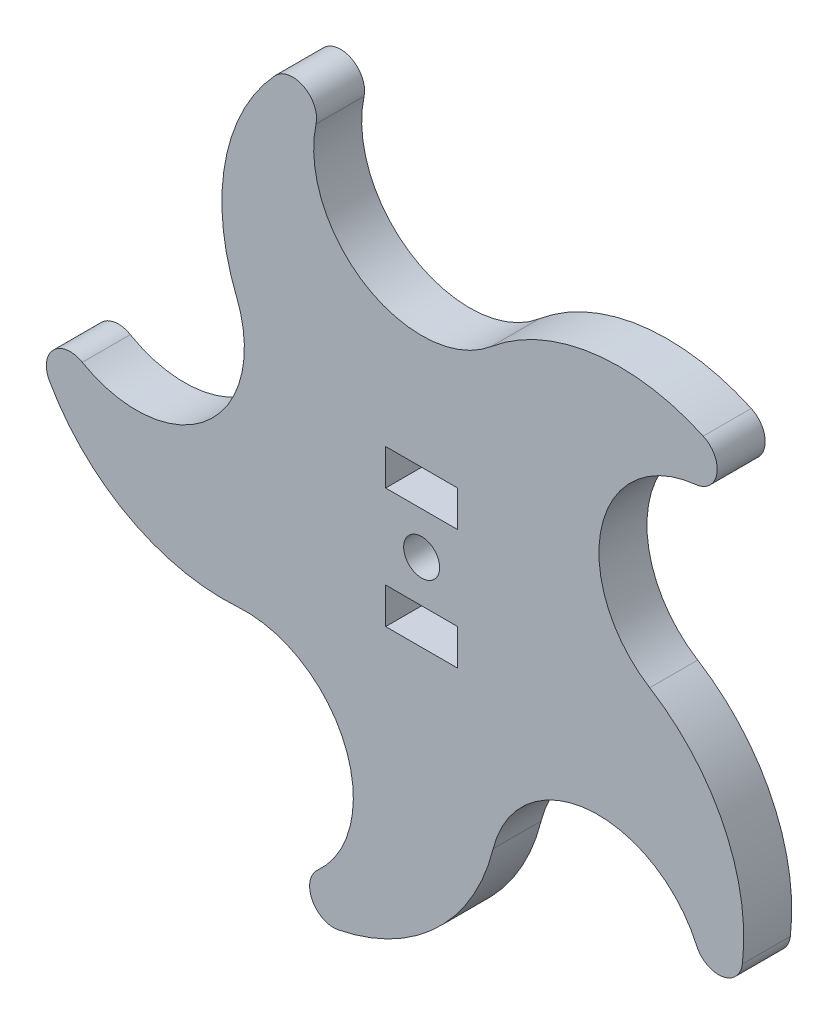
SolidWorks part; units mm, degrees
ref_plane "前视基准面" through (0, 0, 0) normal (0, 0, 1) x (1, 0, 0)
ref_plane "上视基准面" through (0, 0, 0) normal (0, 1, 0) x (1, 0, 0)
ref_plane "右视基准面" through (0, 0, 0) normal (1, 0, 0) x (0, 0, -1)
sketch "草图1" plane through (0, 0, 0) normal (0, 0, 1) x (1, 0, 0)
  line L0 (0, 0) -> (-23.7764, 7.7254) construction
  circle A0 centre (0, 0) radius 12.5
  circle A1 centre (0, 25) radius 12.5
  circle A2 centre (23.7764, 7.7254) radius 12.5
  circle A3 centre (14.6946, -20.2254) radius 12.5
  circle A4 centre (-14.6946, -20.2254) radius 12.5
  circle A5 centre (-23.7764, 7.7254) radius 12.5
  circle A6 centre (-23.7764, 7.7254) radius 10.5
  circle A7 centre (0, 25) radius 10.5
  circle A8 centre (23.7764, 7.7254) radius 10.5
  circle A9 centre (-14.6946, -20.2254) radius 10.5
  circle A10 centre (14.6946, -20.2254) radius 10.5
  circle A11 centre (-23.7764, 7.7254) radius 9
  circle A12 centre (0, 25) radius 9
  circle A13 centre (23.7764, 7.7254) radius 9
  circle A14 centre (14.6946, -20.2254) radius 9
  circle A15 centre (-14.6946, -20.2254) radius 9
  circle A17 centre (0, 0) radius 35.5
  point P16 (0, 0)
  dimension "D1" = 25
  dimension "D2" = 25
  dimension "D4" = 21
  dimension "D5" = 21
  dimension "D6" = 21
  dimension "D7" = 21
  dimension "D8" = 18
  dimension "D11" = 21
  dimension "D3" = 5
  dimension "D10" = 25
  dimension "D9" = 5
sketch "草图2" plane through (0, 0, 0) normal (0, 0, 1) x (1, 0, 0)
  line L10 (0, 0) -> (-16.5005, 5.3613) construction
  circle A26 centre (-14.6946, -20.2254) radius 9 construction
  arc A27 (-8.677, -26.9178) -> (-15.3282, -11.2478) centre (-14.6946, -20.2254) ccw
  circle A28 centre (0, 25) radius 9 construction
  circle A29 centre (14.6946, -20.2254) radius 9 construction
  circle A30 centre (23.7764, 7.7254) radius 9 construction
  circle A31 centre (-23.7764, 7.7254) radius 9 construction
  arc A32 (-8.8021, 26.8772) -> (5.7895, 18.1093) centre (0, 25) ccw
  arc A33 (22.919, -16.5704) -> (5.9606, -18.0538) centre (14.6946, -20.2254) ccw
  arc A34 (22.8418, 16.6768) -> (19.0121, 0.0899) centre (23.7764, 7.7254) ccw
  arc A35 (-28.2817, -0.0657) -> (-15.4339, 11.1023) centre (-23.7764, 7.7254) ccw
  arc A36 (-31.0279, -2.7743) -> (-15.3282, -11.2478) centre (-16.5005, 5.3613) ccw
  arc A37 (-28.2817, -0.0657) -> (-31.0279, -2.7743) centre (-29.2829, -1.7971) ccw
  arc A38 (-8.8021, 26.8772) -> (-12.2267, 28.652) centre (-10.7581, 27.2944) ccw
  arc A39 (-12.2267, 28.652) -> (-15.4339, 11.1023) centre (0, 17.3496) ccw
  arc A40 (22.8418, 16.6768) -> (23.4714, 20.4822) centre (22.6341, 18.6659) ccw
  arc A41 (23.4714, 20.4822) -> (5.7895, 18.1093) centre (16.5005, 5.3613) ccw
  arc A42 (22.919, -16.5704) -> (26.7328, -15.9933) centre (24.7467, -15.7582) ccw
  arc A43 (26.7328, -15.9933) -> (19.0121, 0.0899) centre (10.1978, -14.0361) ccw
  arc A44 (-8.677, -26.9178) -> (-6.9496, -30.3666) centre (-7.3398, -28.405) ccw
  arc A45 (-6.9496, -30.3666) -> (5.9606, -18.0538) centre (-10.1978, -14.0361) ccw
  dimension "D1" = 4
extrude "凸台-拉伸1" add sketch "草图2" along normal blind 4
sketch "草图3" plane through (0, 0, 4) normal (0, 0, 1) x (1, 0, 0)
  line L11 (3, 3.5) -> (-3, 3.5)
  line L14 (-3, 3.5) -> (-3, 6.5)
  line L15 (-3, 6.5) -> (3, 6.5)
  line L16 (3, 6.5) -> (3, 3.5)
  line L17 (3, -3.5) -> (-3, -3.5)
  line L18 (-3, -3.5) -> (-3, -6.5)
  line L19 (-3, -6.5) -> (3, -6.5)
  line L20 (3, -6.5) -> (3, -3.5)
  circle A3 centre (0, 0) radius 1.5
  point P6 (0, 3.5)
  point P12 (0, -3.5)
  dimension "D1" = 3
  dimension "D4" = 6
  dimension "D7" = 3.5
  dimension "D2" = 3.5
  dimension "D3" = 3
  dimension "D5" = 3
  dimension "D6" = 6
extrude "切除-拉伸1" cut sketch "草图3" against normal blind 10
